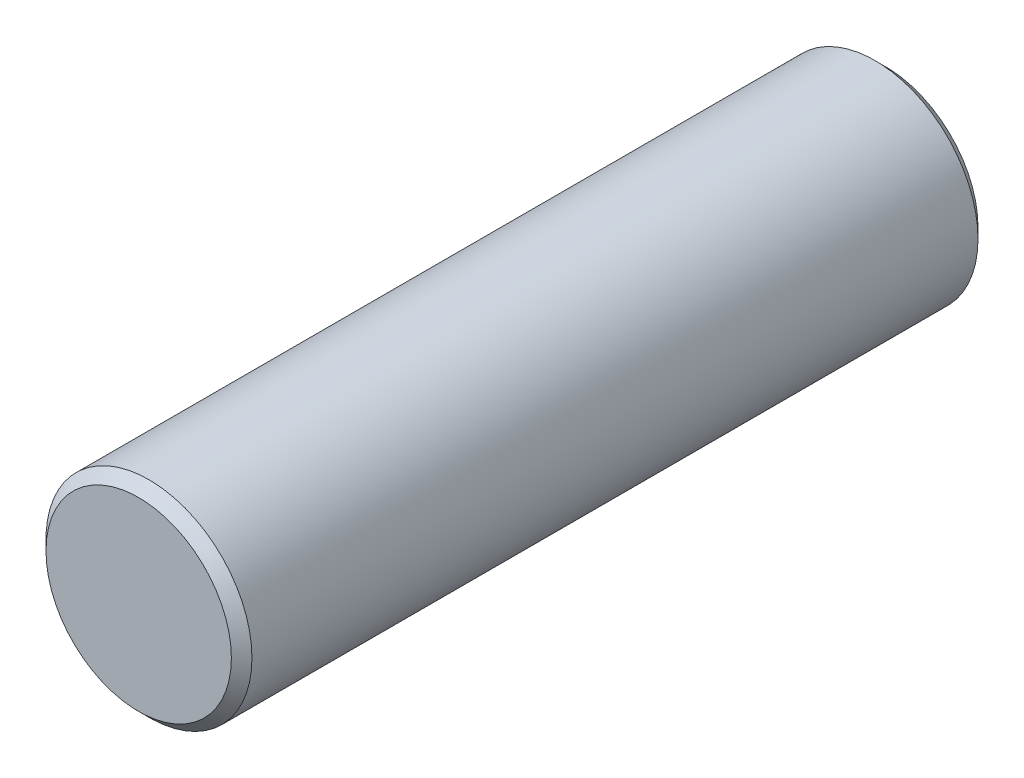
SolidWorks part; units mm, degrees
ref_plane "Plan de face" through (0, 0, 0) normal (0, 0, 1) x (1, 0, 0)
ref_plane "Plan de dessus" through (0, 0, 0) normal (0, 1, 0) x (1, 0, 0)
ref_plane "Plan de droite" through (0, 0, 0) normal (1, 0, 0) x (0, 0, -1)
sketch "Esquisse1" plane through (0, 0, 0) normal (0, 0, 1) x (1, 0, 0)
  circle A0 centre (31.25, 56.0758) radius 2
  circle A1 centre (31.25, 56.0758) radius 2 construction
extrude "Boss.-Extru.1" add sketch "Esquisse1" against normal up to surface (14.5 mm away)
chamfer "Chanfrein1" distance 0.2 angle 45 2 edges at (33.25, 56.0758, 0) (29.25, 56.0758, -14.5)
